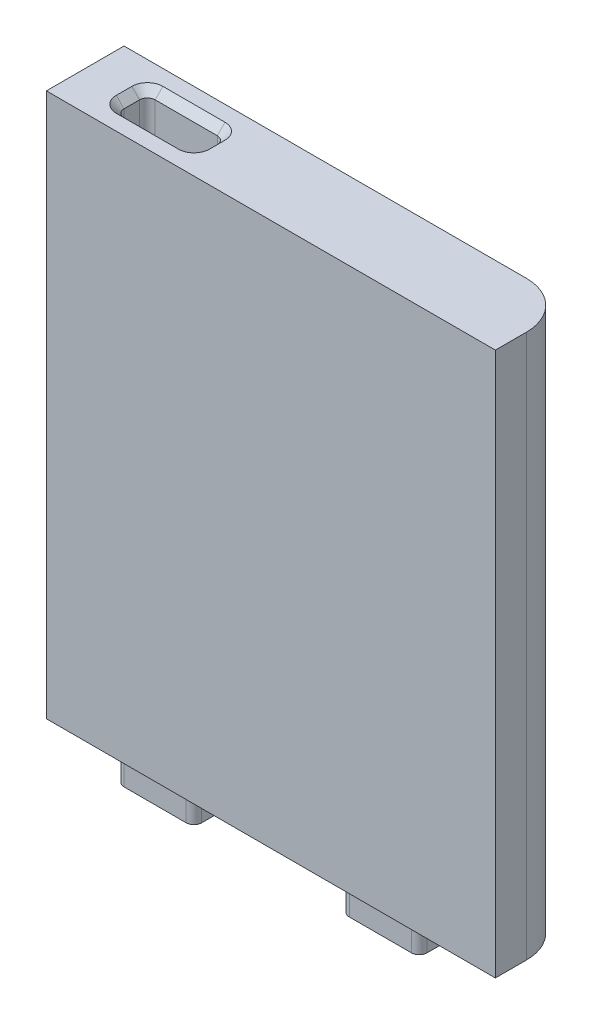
SolidWorks part; units mm, degrees
ref_plane "前视基准面" through (0, 0, 0) normal (0, 0, 1) x (1, 0, 0)
ref_plane "上视基准面" through (0, 0, 0) normal (0, 1, 0) x (1, 0, 0)
ref_plane "右视基准面" through (0, 0, 0) normal (1, 0, 0) x (0, 0, -1)
sketch "草图1" plane through (0, 0, 0) normal (0, 0, 1) x (1, 0, 0)
  line L1 (0, 0) -> (28.9, 0)
  line L2 (0, 0) -> (0, 35)
  line L3 (0, 35) -> (28.9, 35)
  line L4 (28.9, 0) -> (28.9, 35)
  dimension "D1" = 28.9
  dimension "D2" = 35
extrude "凸台-拉伸1" add sketch "草图1" along normal blind 5
fillet "圆角1" radius 3 1 edges at (28.9, 17.5, 0)
sketch "草图3" plane through (0, 0, 0) normal (0, -1, 0) x (1, 0, 0)
  line L0 (0, 5) -> (28.9, 5) construction
  line L1 (3.5, 3.5) -> (7.5, 3.5)
  line L2 (3, 3) -> (3, 2)
  line L3 (3.5, 1.5) -> (7.5, 1.5)
  line L4 (8, 3) -> (8, 2)
  line L5 (0, 5) -> (0, 0) construction
  arc A0 (7.5, 3.5) -> (8, 3) centre (7.5, 3) cw
  arc A1 (7.5, 1.5) -> (8, 2) centre (7.5, 2) ccw
  arc A2 (3, 2) -> (3.5, 1.5) centre (3.5, 2) ccw
  arc A3 (3.5, 3.5) -> (3, 3) centre (3.5, 3) ccw
  point P10 (8, 3.5)
  point P13 (8, 1.5)
  point P18 (3, 3.5)
  dimension "D5" = 0.5
  dimension "D1" = 1.5
  dimension "D2" = 3
  dimension "D3" = 5
  dimension "D4" = 2
extrude "凸台-拉伸3" add sketch "草图3" along normal blind 2.8
sketch "草图4" plane through (0, 35, 0) normal (0, 1, 0) x (1, 0, 0)
  line L1 (0, -5) -> (0, 0) construction
  line L2 (3.5, -1.5) -> (7.5, -1.5)
  line L3 (3, -2) -> (3, -3)
  line L4 (3.5, -3.5) -> (7.5, -3.5)
  line L5 (8, -2) -> (8, -3)
  line L6 (28.9, -5) -> (0, -5) construction
  arc A0 (7.5, -1.5) -> (8, -2) centre (7.5, -2) cw
  arc A1 (7.5, -3.5) -> (8, -3) centre (7.5, -3) ccw
  arc A2 (3, -3) -> (3.5, -3.5) centre (3.5, -3) ccw
  arc A3 (3.5, -1.5) -> (3, -2) centre (3.5, -2) ccw
  point P10 (8, -1.5)
  point P13 (8, -3.5)
  point P18 (3, -1.5)
  dimension "D5" = 0.5
  dimension "D2" = 5
  dimension "D1" = 3
  dimension "D3" = 2
  dimension "D4" = 1.5
extrude "切除-拉伸1" cut sketch "草图4" against normal blind 3
pattern_linear "阵列(线性)1" count 2 spacing 14.5 along (1, 0, 0) of "凸台-拉伸3"
chamfer "倒角1" distance 0.5 angle 45 8 edges at (7.8536, 35, 1.6464) (8, 35, 2.5) (7.8536, 35, 3.3536) (5.5, 35, 3.5) (3.1464, 35, 3.3536) (3, 35, 2.5) (3.1464, 35, 1.6464) (5.5, 35, 1.5)
sketch "草图2" plane through (0, 35, 0) normal (0, 1, 0) x (1, 0, 0)
  line L0 (28.9, -5) -> (0, -5) construction
  circle A0 centre (26.4, -5) radius 0.95
  dimension "D1" = 1.9
  dimension "D2" = 2.5
extrude "凸台-拉伸2" add sketch "草图2" against normal up to surface (35 mm away)
